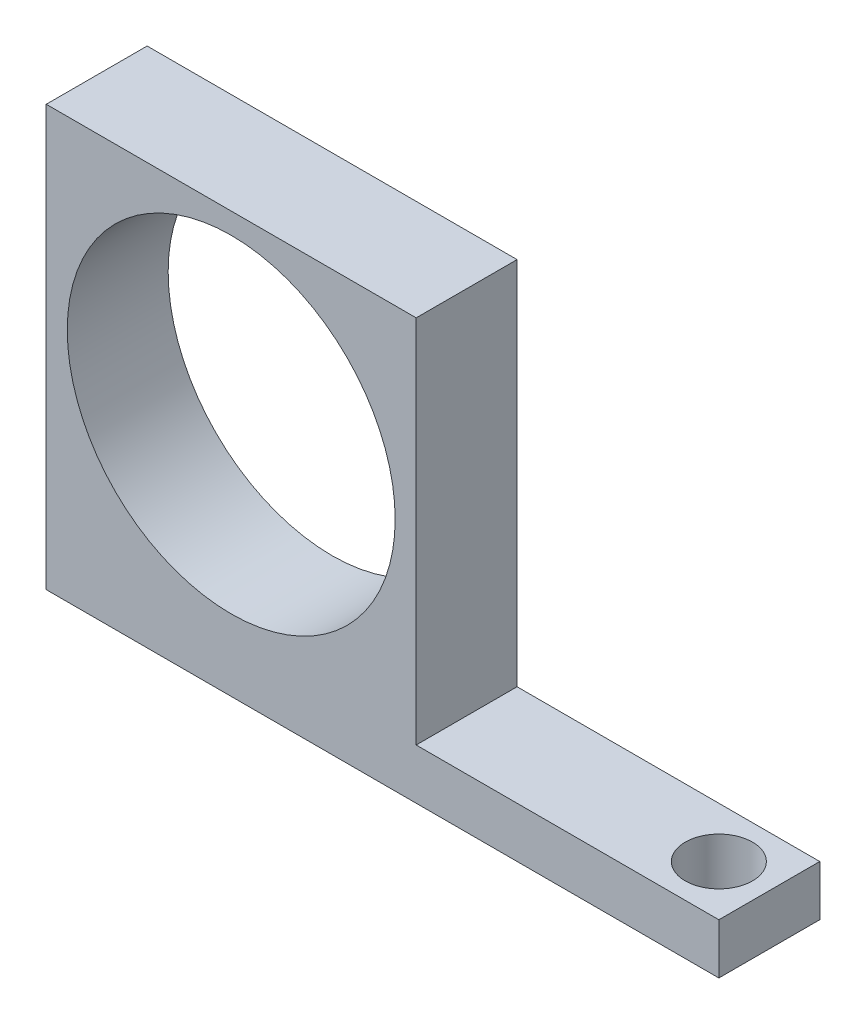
SolidWorks part; units mm, degrees
ref_plane "Front Plane" through (0, 0, 0) normal (0, 0, 1) x (1, 0, 0)
ref_plane "Top Plane" through (0, 0, 0) normal (0, 1, 0) x (1, 0, 0)
ref_plane "Right Plane" through (0, 0, 0) normal (1, 0, 0) x (0, 0, -1)
sketch "Sketch2" plane through (0, 0, 0) normal (0, 1, 0) x (1, 0, 0)
  line L1 (0, 0) -> (-40, 0)
  line L2 (0, 0) -> (0, 6)
  line L3 (0, 6) -> (-40, 6)
  line L4 (-40, 0) -> (-40, 6)
  circle A0 centre (-3, 3) radius 2
  dimension "D1" = 4
  dimension "D2" = 40
  dimension "D3" = 6
  dimension "D4" = 3
  dimension "D5" = 3
extrude "Boss-Extrude1" add sketch "Sketch2" along normal blind 3
sketch "Sketch3" plane through (0, 3, 0) normal (0, 1, 0) x (1, 0, 0)
  line L0 (-40, 0) -> (0, 0) construction
  line L1 (-40, 6) -> (-18, 6)
  line L2 (-40, 6) -> (-40, 0)
  line L3 (-40, 0) -> (-18, 0)
  line L4 (-18, 6) -> (-18, 0)
  dimension "D1" = 22
extrude "Boss-Extrude2" add sketch "Sketch3" along normal blind 22
sketch "Sketch4" plane through (0, 0, -6) normal (0, 0, -1) x (-1, 0, 0)
  line L0 (29, 25) -> (29, 0) construction
  line L1 (18, 25) -> (40, 25) construction
  line L2 (0, 0) -> (40, 0) construction
  line L3 (18, 14) -> (40, 14) construction
  line L4 (18, 25) -> (18, 3) construction
  line L5 (40, 25) -> (40, 0) construction
  circle A0 centre (29, 14) radius 9.75
  point P14 (0, 0)
  point P15 (0, 0)
  point P16 (29, 14)
  dimension "D1" = 19.5
extrude "Cut-Extrude1" cut sketch "Sketch4" against normal up to next
